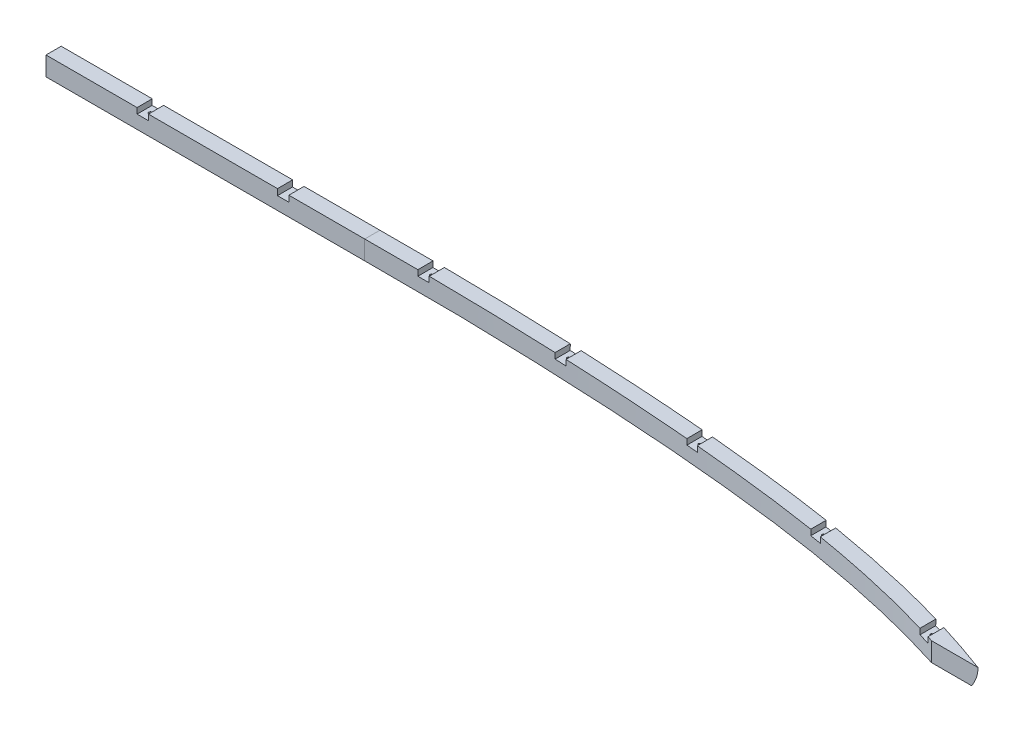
SolidWorks part; units mm, degrees
other "<0 TAIL FLANGE BASE PART>-<#8-32 Tapped Hole2>"
other "<0 TAIL FLANGE BASE PART>-<#8-32 Tapped Hole1>"
ref_plane "FRONT" through (0, 0, 0) normal (0, 0, 1) x (1, 0, 0)
ref_plane "TOP" through (0, 0, 0) normal (0, 1, 0) x (1, 0, 0)
ref_plane "SIDE" through (0, 0, 0) normal (1, 0, 0) x (0, 0, -1)
mirrored part "0 TAIL FLANGE BASE PART_Mirrored"
sketch "Sketch1" plane through (-101.6, 0, 0) normal (-1, 0, 0) x (0, 0, 1)
  line L3 (-258.4068, -31.75) -> (-234.9498, -31.75) construction
  line L4 (-234.9498, -31.75) -> (-234.9498, 0) construction
  line L5 (-260.35, 0) -> (-234.9498, 0) construction
  line L6 (-258.4068, -31.75) -> (-234.9498, -31.75)
  line L7 (-234.9498, -31.75) -> (-234.9498, 0)
  line L8 (-260.35, 0) -> (-234.9498, 0)
  arc A1 (-260.35, 0) -> (-258.4068, -31.75) centre (0, 0) ccw construction
  arc A2 (-260.35, 0) -> (-258.4068, -31.75) centre (0, 0) ccw
extrude "Extrude1" add sketch "Sketch1" along normal up to surface (533.4 mm away)
sketch "Sketch2" plane through (0, 0, -234.9498) normal (0, 0, 1) x (1, 0, 0)
  line L1 (-463.55, -9.525) -> (-482.6, -9.525)
  line L3 (-463.55, 0) -> (-482.6, 0)
  line L4 (-482.6, -9.525) -> (-482.6, 0)
  line L6 (-463.55, -9.525) -> (-463.55, 0)
  line L7 (-635, 0) -> (-101.6, 0) construction
  line L8 (-228.6, -10.2365) -> (-247.65, -10.2365)
  line L9 (-228.6, 0) -> (-247.65, 0)
  line L10 (-247.65, -10.2365) -> (-247.65, 0)
  line L11 (-228.6, -10.2365) -> (-228.6, 0)
  line L12 (-12.7, 0) -> (-12.7, -9.525) construction
  dimension "D1" = 19.05
  dimension "D2" = 19.05
  dimension "D3" = 234.95
  dimension "D4" = 234.95
extrude "Cut-Extrude1" cut sketch "Sketch2" against normal through all
hole_wizard "Tapped Drilled Hole2" positions "Sketch32" profile "Sketch22" legacy
sketch "Sketch32" plane through (-480.2567, -9.525, -255.7662) normal (0, 1, 0) x (-1, 0, 0)
  line L0 (-242.1317, 75.3123) -> (-242.1317, -57.6107) construction
  line L2 (-251.6567, -4.5838) -> (-251.6567, 20.8164) construction
  line L3 (-232.6067, -4.5838) -> (-232.6067, 20.8164) construction
  line L4 (-269.6217, 8.1153) -> (23.2902, 8.1153) construction
  point P0 (-7.1817, 8.1153)
  point P9 (-242.1317, 8.8508)
sketch "Sketch22" plane through (-473.075, -9.525, -247.6509) normal (1, 0, 0) x (0, 0, 1)
  line L0 (0, 0) -> (0, 7.9601)
  line L1 (0, 7.9601) -> (2.6797, 6.35)
  line L2 (2.6797, 6.35) -> (2.6797, 0)
  line L4 (2.6797, 0) -> (0, 0)
  line L6 (0, 7.9601) -> (-2.6797, 6.35) construction
  line L7 (0, -4.2442) -> (0, 117.3081) construction
  dimension "Diameter" = 5.3594
  dimension "Depth" = 6.35
  dimension "Drill Angle" = 118
